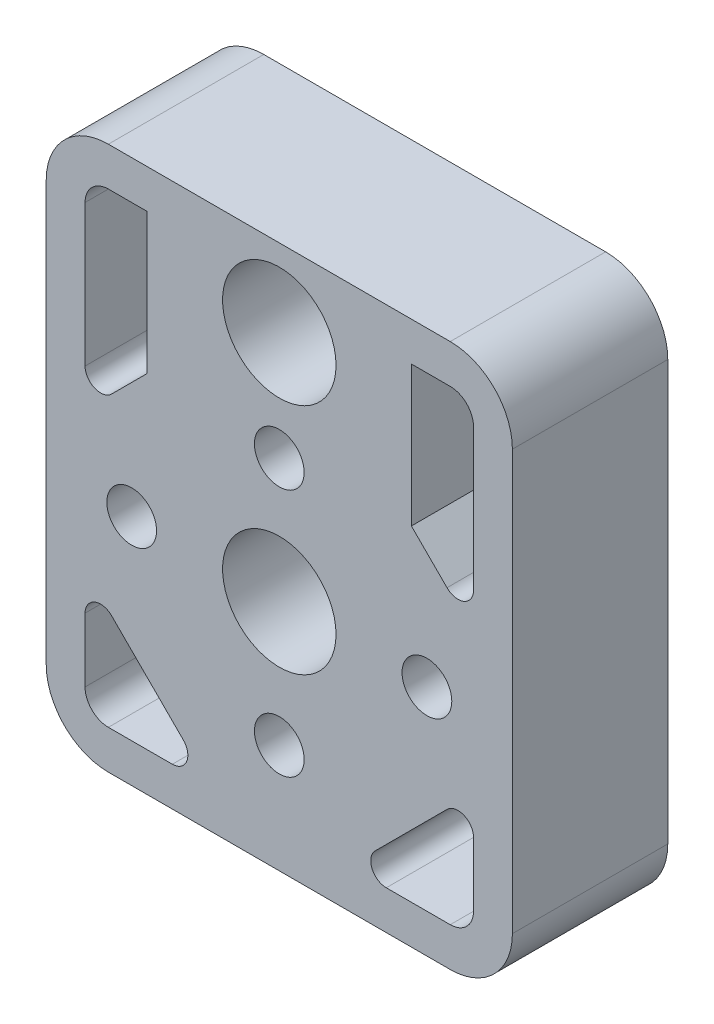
SolidWorks part; units mm, degrees
ref_plane "Front Plane" through (0, 0, 0) normal (0, 0, 1) x (1, 0, 0)
ref_plane "Top Plane" through (0, 0, 0) normal (0, 1, 0) x (1, 0, 0)
ref_plane "Right Plane" through (0, 0, 0) normal (1, 0, 0) x (0, 0, -1)
sketch "Sketch1" plane through (0, 0, 0) normal (0, 0, 1) x (1, 0, 0)
  line L0 (5.5, 15) -> (24.5, 15) construction
  line L1 (0, 0) -> (30, 0)
  line L2 (0, 0) -> (0, 35)
  line L3 (0, 35) -> (30, 35)
  line L4 (30, 0) -> (30, 35)
  line L5 (15, 7) -> (15, 23) construction
  circle A0 centre (15, 30) radius 2.05
  circle A1 centre (15, 15) radius 2.1
  circle A2 centre (5.5, 15) radius 1.6
  circle A3 centre (24.5, 15) radius 1.6
  circle A4 centre (15, 7) radius 1.6
  circle A5 centre (15, 23) radius 1.6
  point P10 (15, 0)
  point P14 (15, 15)
  point P18 (15, 15)
  dimension "D3" = 4.1
  dimension "D4" = 4.2
  dimension "D10" = 3.2
  dimension "D1" = 35
  dimension "D2" = 30
  dimension "D5" = 15
  dimension "D6" = 5
  dimension "D8" = 19
  dimension "D9" = 16
extrude "Boss-Extrude1" add sketch "Sketch1" along normal blind 10
sketch "Sketch2" plane through (0, 0, 0) normal (0, 0, -1) x (-1, 0, 0)
  circle A0 centre (-15, 7) radius 2.85
  circle A1 centre (-24.5, 15) radius 2.85
  circle A2 centre (-15, 23) radius 2.85
  circle A3 centre (-5.5, 15) radius 2.85
  circle A4 centre (-15, 7) radius 1.6 construction
  circle A5 centre (-24.5, 15) radius 1.6 construction
  circle A6 centre (-5.5, 15) radius 1.6 construction
  circle A7 centre (-15, 23) radius 1.6 construction
  dimension "D1" = 5.7
extrude "Cut-Extrude1" cut sketch "Sketch2" against normal blind 5
sketch "Sketch3" plane through (0, 0, 10) normal (0, 0, 1) x (1, 0, 0)
  circle A0 centre (15, 15) radius 3.65
  circle A1 centre (15, 30) radius 3.65
  circle A2 centre (15, 30) radius 2.05 construction
  circle A3 centre (15, 15) radius 2.1 construction
  dimension "D1" = 7.3
extrude "Cut-Extrude2" cut sketch "Sketch3" against normal blind 7
fillet "Fillet1" radius 4 4 edges at (0, 35, 5) (30, 35, 5) (30, 0, 5) (0, 0, 5)
sketch "Sketch5" plane through (0, 0, 10) normal (0, 0, 1) x (1, 0, 0)
  line L4 (6.5, 32.5) -> (6.5, 23.4706)
  line L5 (6.5, 23.4706) -> (4.2071, 21.1777)
  line L6 (4.2071, 8.8223) -> (8.8223, 4.2071)
  line L7 (2.5, 8.1152) -> (2.5, 4)
  line L8 (27.5, 4) -> (27.5, 31)
  line L9 (4, 2.5) -> (26, 2.5)
  line L10 (2.5, 31) -> (2.5, 4)
  line L11 (26, 32.5) -> (4, 32.5)
  line L13 (4, 2.5) -> (8.1152, 2.5)
  line L14 (2.5, 31) -> (2.5, 21.8848)
  line L15 (6.5, 32.5) -> (4, 32.5)
  line L16 (15, 15) -> (15, 30) construction
  line L17 (26, 2.5) -> (21.8848, 2.5)
  line L18 (27.5, 8.1152) -> (27.5, 4)
  line L19 (23.5, 32.5) -> (26, 32.5)
  line L20 (27.5, 31) -> (27.5, 21.8848)
  line L21 (25.7929, 8.8223) -> (21.1777, 4.2071)
  line L22 (23.5, 23.4706) -> (25.7929, 21.1777)
  line L23 (23.5, 32.5) -> (23.5, 23.4706)
  circle A4 centre (15, 15) radius 2.1 construction
  arc A5 (4.2071, 8.8223) -> (2.5, 8.1152) centre (3.5, 8.1152) ccw
  arc A6 (8.8223, 4.2071) -> (8.1152, 2.5) centre (8.1152, 3.5) cw
  arc A7 (4.2071, 21.1777) -> (2.5, 21.8848) centre (3.5, 21.8848) cw
  circle A8 centre (15, 15) radius 3.65 construction
  arc A9 (27.5, 31) -> (26, 32.5) centre (26, 31) ccw
  arc A11 (26, 2.5) -> (27.5, 4) centre (26, 4) ccw
  arc A17 (2.5, 4) -> (4, 2.5) centre (4, 4) ccw
  arc A18 (2.5, 4) -> (4, 2.5) centre (4, 4) ccw
  arc A19 (4, 32.5) -> (2.5, 31) centre (4, 31) ccw
  arc A20 (4, 32.5) -> (2.5, 31) centre (4, 31) ccw
  circle A21 centre (15, 30) radius 3.65 construction
  arc A22 (27.5, 4) -> (26, 2.5) centre (26, 4) cw
  arc A23 (26, 32.5) -> (27.5, 31) centre (26, 31) cw
  arc A24 (25.7929, 21.1777) -> (27.5, 21.8848) centre (26.5, 21.8848) ccw
  arc A25 (21.1777, 4.2071) -> (21.8848, 2.5) centre (21.8848, 3.5) ccw
  arc A26 (25.7929, 8.8223) -> (27.5, 8.1152) centre (26.5, 8.1152) cw
  point P13 (2.5, 10.5294)
  point P37 (27.5, 10.5294)
  dimension "D6" = 12
  dimension "D7" = 1
  dimension "D2" = 45
  dimension "D3" = 45
  dimension "D4" = 4
  dimension "D5" = 12
  dimension "D1" = 2.5
extrude "Cut-Extrude3" cut sketch "Sketch5" against normal through all
